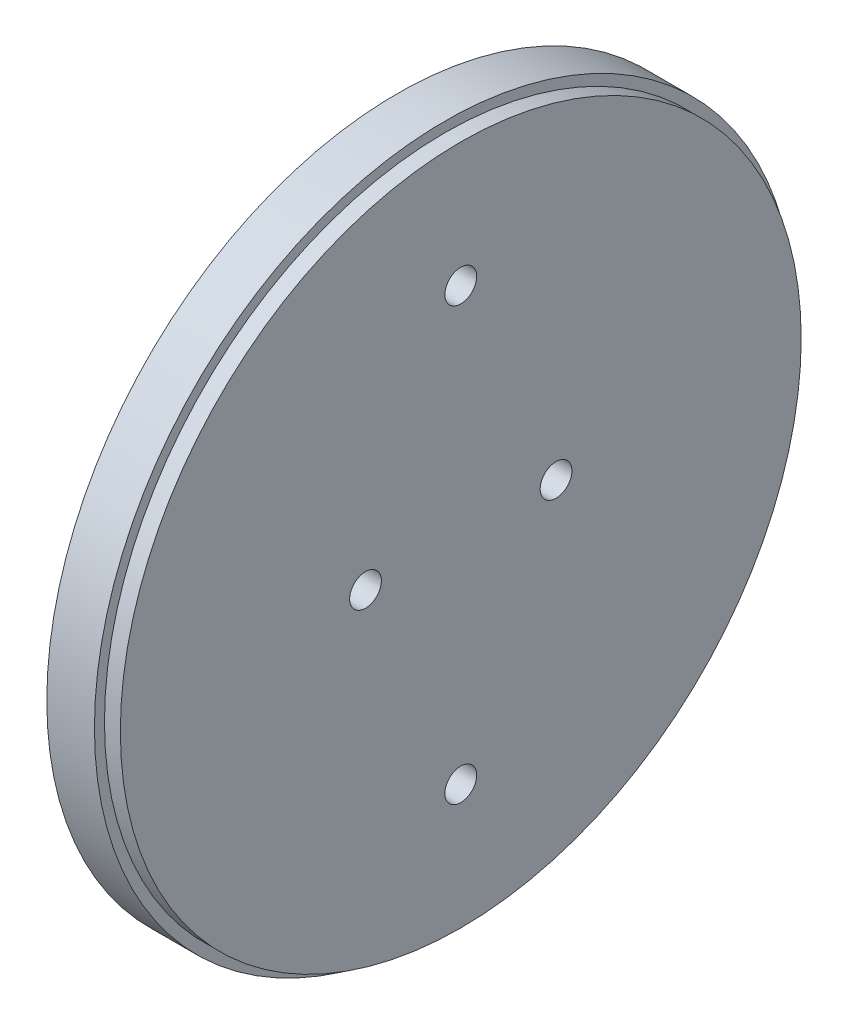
SolidWorks part; units mm, degrees
ref_plane "Front Plane" through (0, 0, 0) normal (0, 0, 1) x (1, 0, 0)
ref_plane "Top Plane" through (0, 0, 0) normal (0, 1, 0) x (1, 0, 0)
ref_plane "Right Plane" through (0, 0, 0) normal (1, 0, 0) x (0, 0, -1)
sketch "Sketch1" plane through (0, 0, 0) normal (1, 0, 0) x (0, 0, -1)
  circle A0 centre (0, 0) radius 70.0786
  dimension "D1" = 140.1572
extrude "Boss-Extrude1" add sketch "Sketch1" along normal blind 9.525
sketch "Sketch3" plane through (9.525, 0, 0) normal (1, 0, 0) x (0, 0, -1)
  circle A0 centre (0, 0) radius 68.072
  dimension "D1" = 136.144
extrude "Boss-Extrude2" add sketch "Sketch3" along normal blind 3.175
sketch "Sketch2" plane through (9.525, 0, 0) normal (1, 0, 0) x (0, 0, -1)
  line L0 (0, 70.0786) -> (0, -70.0786) construction
  line L1 (-70.0786, 0) -> (70.0786, 0) construction
  circle A0 centre (19.05, 0) radius 3.175
  circle A1 centre (-19.05, 0) radius 3.175
  circle A3 centre (0, 0) radius 70.0786 construction
  circle A6 centre (0, 43.18) radius 3.175
  circle A7 centre (0, -43.18) radius 3.175
  point P6 (0, 0)
  point P12 (0, 0)
  dimension "D2" = 6.35
  dimension "D3" = 6.35
  dimension "D4" = 43.18
  dimension "D1" = 19.05
extrude "Cut-Extrude1" cut sketch "Sketch2" against normal through all both and the other way through all
